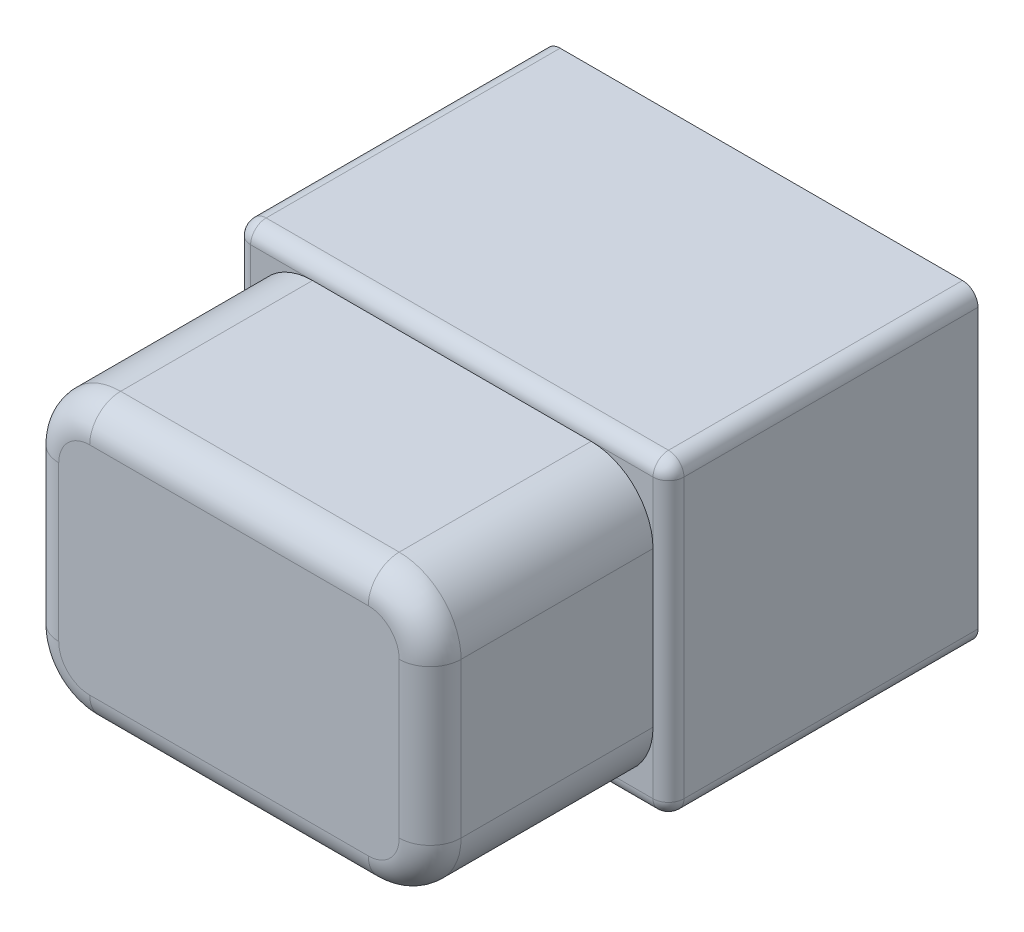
SolidWorks part; units mm, degrees
ref_plane "Front Plane" through (0, 0, 0) normal (0, 0, 1) x (1, 0, 0)
ref_plane "Top Plane" through (0, 0, 0) normal (0, 1, 0) x (1, 0, 0)
ref_plane "Right Plane" through (0, 0, 0) normal (1, 0, 0) x (0, 0, -1)
imported_body "Imported1"
ref_plane "Plane1" through (0, 0, 50) normal (0, 0, 1) x (1, 0, 0)
split "Split1" trim tools "Plane1" bodies to split 101 resulting bodies 102 103
